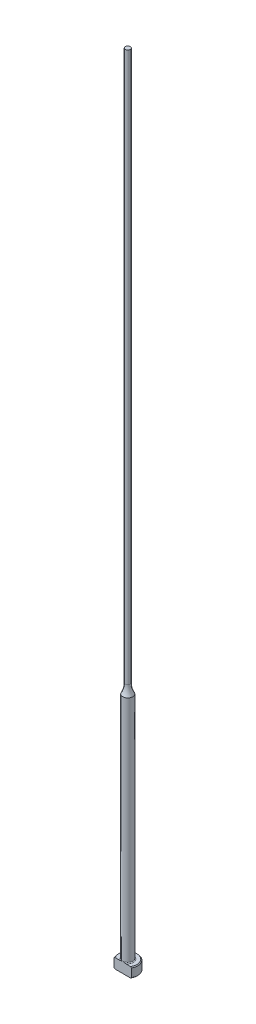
SolidWorks part; units mm, degrees
ref_plane "Front Plane" through (0, 0, 0) normal (0, 0, 1) x (1, 0, 0)
ref_plane "Top Plane" through (0, 0, 0) normal (0, 1, 0) x (1, 0, 0)
ref_plane "Right Plane" through (0, 0, 0) normal (1, 0, 0) x (0, 0, -1)
sketch "Sketch1" plane through (0, 0, 0) normal (0, 0, 1) x (1, 0, 0)
  line L0 (0, 259.9588) -> (0, -15.1925) construction
  line L1 (0, 0) -> (-3.175, 0)
  line L2 (-3.175, 0) -> (-3.175, 3.175)
  line L3 (-3.175, 3.175) -> (-1.5875, 3.175)
  line L4 (-0.7937, 79.2742) -> (-0.7937, 254)
  line L5 (-0.7937, 254) -> (0, 254)
  line L6 (0, 254) -> (0, 0)
  line L7 (-1.5875, 3.175) -> (-1.5875, 76.2)
  arc A0 (-1.5875, 76.2) -> (-0.7937, 79.2742) centre (-7.1437, 79.2742) ccw
  point P13 (-1.5875, 0)
  dimension "D1" = 6.35
  dimension "L" = 254
  dimension "D2" = 3.175
  dimension "H" = 6.35
  dimension "T" = 3.175
  dimension "D" = 1.5875
  dimension "S" = 76.2
revolve "Revolve1" add sketch "Sketch1" angle 360 about L0
chamfer "Chamfer1" distance 0.254 angle 45 2 edges at (0, 3.175, 3.175) (0, 0, 3.175)
fillet "Fillet1" radius 0.254 1 edges at (0, 3.175, 1.5875)
sketch "Sketch2" plane through (0, 0, 0) normal (0, -1, 0) x (1, 0, 0)
  line L0 (-2.7496, 1.5875) -> (2.7496, 1.5875)
  circle A0 centre (0, 0) radius 3.175 construction
  arc A1 (2.7496, 1.5875) -> (-2.7496, 1.5875) centre (0, 0) ccw
  circle A4 centre (0, 0) radius 1.5875 construction
  dimension "D1" = 0
extrude "KEY" cut sketch "Sketch2" against normal through all
